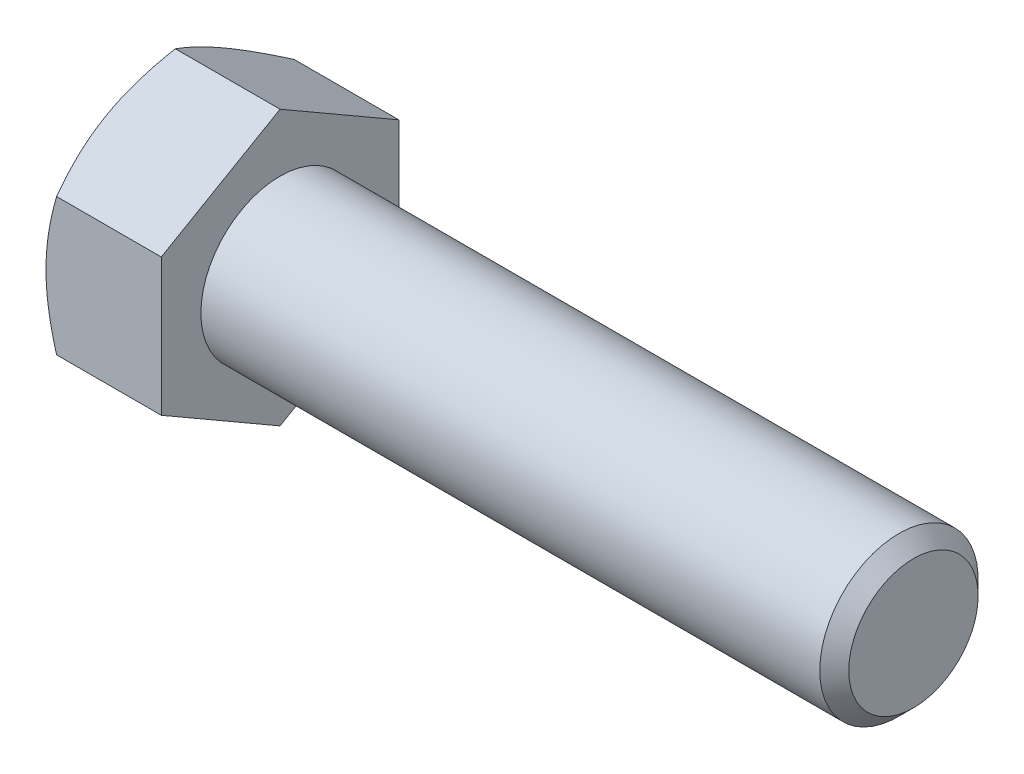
SolidWorks part; units mm, degrees
ref_plane "Plane1" through (0, 0, 0) normal (0, 0, 1) x (1, 0, 0)
ref_plane "Plane2" through (0, 0, 0) normal (0, 1, 0) x (1, 0, 0)
ref_plane "Plane3" through (0, 0, 0) normal (1, 0, 0) x (0, 0, -1)
sketch "Sketch1" plane through (0, 0, 0) normal (1, 0, 0) x (0, 0, -1)
  line L0 (9.525, 5.4993) -> (9.525, -5.4993)
  line L1 (-9.525, 5.4993) -> (-9.525, -5.4993)
  line L2 (9.525, -5.4993) -> (0, -10.9985)
  line L3 (0, -10.9985) -> (-9.525, -5.4993)
  line L4 (9.525, 5.4993) -> (0, 10.9985)
  line L5 (0, 10.9985) -> (-9.525, 5.4993)
  dimension "Width_flats" = 19.05
  dimension "D2" = 120
  dimension "D3" = 9.525
  dimension "D4" = 9.525
  dimension "D5" = 9.525
extrude "BaseHead" add sketch "Sketch1" along normal blind 9.2456
sketch "BodySke" plane through (0, 0, 0) normal (0, 0, 1) x (1, 0, 0)
  line L0 (0, 5.4993) -> (0, -5.4993) construction
  line L1 (0, 0) -> (60.0456, 0)
  line L2 (0, 0) -> (0, 6.35)
  line L3 (0, 6.35) -> (58.8823, 6.35)
  line L4 (60.0456, 0) -> (60.0456, 5.1867)
  line L5 (9.2456, 10.9985) -> (9.2456, 5.4993) construction
  line L6 (60.0456, 5.1867) -> (58.8823, 6.35)
  line L7 (0, 0) -> (96.52, 0) construction
  line L8 (60.0456, -5.1867) -> (58.8823, -6.35) construction
  line L9 (0, -6.35) -> (58.8823, -6.35) construction
  line L10 (11.1989, 15.24) -> (11.1989, -2.54) construction
  line L11 (28.2956, 15.24) -> (28.2956, -2.54) construction
  line L12 (9.2456, 5.4993) -> (9.2456, -5.4993) construction
  dimension "Length" = 50.8
  dimension "Body_ch_ang" = 45
  dimension "Diameter" = 12.7
  dimension "Minor_dia" = 10.3734
  dimension "Advance" = 1.9533
  dimension "Thread_nom" = 31.75
revolve "BaseBody" add sketch "BodySke" angle 360 about L7
sketch "Sketch3" plane through (0, 0, 0) normal (0, 0, 1) x (1, 0, 0)
  line L0 (0, 9.525) -> (4.5169, 17.3485)
  line L1 (0, 10.9985) -> (0, 5.4993) construction
  line L2 (4.5169, 17.3485) -> (4.5169, 23.6985)
  line L3 (4.5169, 23.6985) -> (-12.7, 23.6985)
  line L4 (-12.7, 23.6985) -> (-12.7, 9.525)
  line L5 (-12.7, 9.525) -> (0, 9.525)
  line L6 (0, 0) -> (99.06, 0) construction
  line L7 (9.2456, 10.9985) -> (0, 10.9985) construction
  dimension "D1" = 9.525
  dimension "D2" = 6.35
  dimension "D3" = 12.7
  dimension "D4" = 6.35
  dimension "Head_ch_ang" = 30
revolve "HeadChamfer" cut sketch "Sketch3" angle 360 about L6
fillet "HeadFillet" [suppressed] radius 0.762
sketch "ThdSchSke" plane through (0, 0, 0) normal (0, 0, 1) x (1, 0, 0)
  line L0 (28.2956, -5.1867) -> (27.481, -6.35)
  line L1 (28.2956, -5.1867) -> (29.1102, -6.35)
  line L2 (29.1102, -6.35) -> (29.1102, -7.9375)
  line L3 (-3.175, 0) -> (5.1513, 0) construction
  line L5 (29.1102, -7.9375) -> (27.481, -7.9375)
  line L6 (27.481, -7.9375) -> (27.481, -6.35)
  dimension "Thread_minor" = 10.3734
  dimension "Diameter" = 12.7
  dimension "Start" = 28.2956
  dimension "SideAngle" = 55
  dimension "VeeAngle" = 70
  dimension "Overcut" = 15.875
revolve "ThreadSchematic" [suppressed] cut sketch "ThdSchSke" angle 360 about L3
pattern_linear "ThdSchPat" [suppressed]
equation "\"D3@Sketch1\" = \"Width_flats@Sketch1\" / 2"
equation "\"D4@Sketch1\" = \"D3@Sketch1\""
equation "\"D5@Sketch1\" = \"D4@Sketch1\""
equation "\"Thread_minor@ThreadCosmetic\" = \"Minor_dia@BodySke\""
equation "\"D1@Sketch3\" = \"Width_flats@Sketch1\" / 2"
equation "\"Thread_length@ThreadCosmetic\" = ((sgn( (\"Length@BodySke\" - \"Advance@BodySke\" ) - \"Thread_nom@BodySke\" )-1)*( (\"Length@BodySke\" - \"Advance@BodySke\" ) - \"Thread_nom@BodySke\" ))/-2+ \"Thread_nom@BodySke\""
equation "\"Thread_minor@ThdSchSke\" = \"Minor_dia@BodySke\""
equation "\"Diameter@ThdSchSke\" = \"Diameter@BodySke\""
equation "\"Overcut@ThdSchSke\" = \"Diameter@BodySke\" * 1.25"
equation "\"Start@ThdSchSke\" = \"Head_ht@BaseHead\" + \"Length@BodySke\" - \"Thread_length@ThreadCosmetic\"  '---Non-countersunk---"
equation "\"Num_threads@ThdSchPat\" = int( \"Thread_length@ThreadCosmetic\" / \"Advance@BodySke\" + 0.999 )  + 1"
equation "\"Advance@ThdSchPat\" = \"Thread_length@ThreadCosmetic\" /  (\"Num_threads@ThdSchPat\" - 1) 'relax it"
equation "\"Num_threads@ThdSchPat\" = \"Num_threads@ThdSchPat\" - sgn( \"Num_threads@ThdSchPat\" - 1) '---chamfered tips only---"
